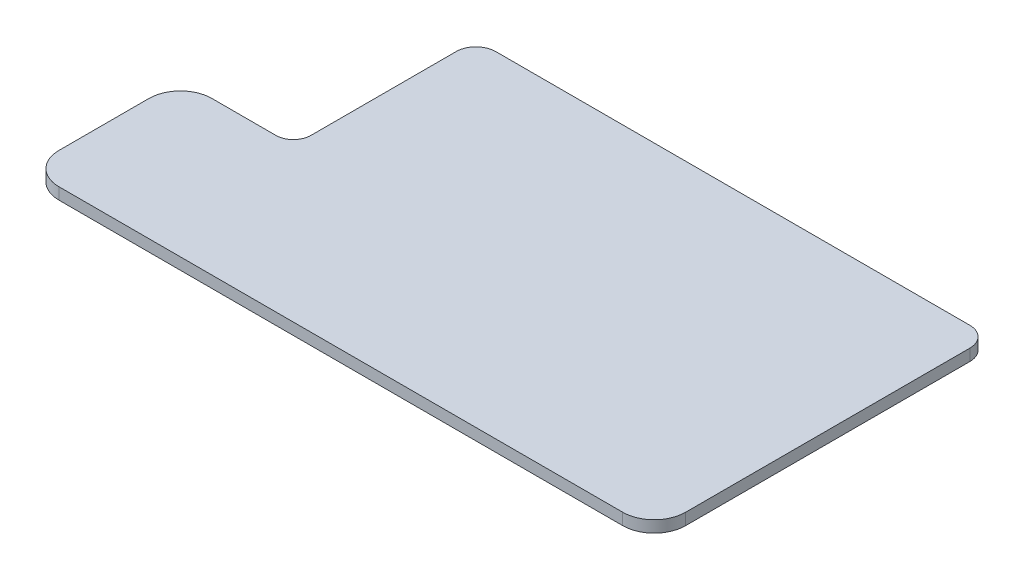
SolidWorks part; units mm, degrees
ref_plane "前视基准面" through (0, 0, 0) normal (0, 0, 1) x (1, 0, 0)
ref_plane "上视基准面" through (0, 0, 0) normal (0, 1, 0) x (1, 0, 0)
ref_plane "右视基准面" through (0, 0, 0) normal (1, 0, 0) x (0, 0, -1)
sketch "草图1" plane through (0, 0, 0) normal (0, 1, 0) x (1, 0, 0)
  line L1 (-26.9, 14.4) -> (26.9, 14.4)
  line L2 (-26.9, 14.4) -> (-26.9, -14.4)
  line L3 (-26.9, -14.4) -> (26.9, -14.4)
  line L4 (26.9, 14.4) -> (26.9, -14.4)
  line L5 (-26.9, 14.4) -> (26.9, -14.4) construction
  line L6 (-26.9, -14.4) -> (26.9, 14.4) construction
  point P0 (0, 0)
  dimension "D1" = 53.8
  dimension "D2" = 28.8
base flange "基体-法兰1" sketch "草图1" thickness 1 reverse thickness direction no parameters "D1"=0.7366
sketch "草图6" plane through (0, -1, 0) normal (0, -1, 0) x (1, 0, 0)
  line L0 (-26.9, 1.2705) -> (-17.2, 1.2705)
  line L1 (-26.9, -14.4) -> (-26.9, 14.4) construction
  line L2 (-17.2, 1.2705) -> (-17.2, -14.4)
  line L3 (26.9, -14.4) -> (-26.9, -14.4) construction
  line L6 (-26.9, 1.2705) -> (-26.9, -14.4)
  line L7 (-26.9, -14.4) -> (-17.2, -14.4)
  line L8 (-23.565, 1.1205) -> (-19.435, 1.1205) construction
  dimension "D1" = 0.15
  dimension "D2" = 9.7
extrude "切除-拉伸1" cut sketch "草图6" against normal blind 2.5
fillet "圆角1" radius 1.7 2 edges at (26.9, -0.5, -14.4) (-17.2, -0.5, -14.4)
fillet "圆角2" radius 2.7 3 edges at (26.9, -0.5, 14.4) (-26.9, -0.5, 14.4) (-26.9, -0.5, 1.2705)
fillet "圆角3" radius 1.5 1 edges at (-17.2, -0.5, 1.2705)
sketch "折弯-线1" [suppressed] plane through (0, 0, 0) normal (0, 1, 0) x (1, 0, 0)
sketch "边界框1" [suppressed] plane through (0, 0, 0) normal (0, 1, 0) x (1, 0, 0)
sheet metal parameters "钣金6" thickness 1 parameters "D1"=0.7366
flat pattern "平板型式6"
sketch "折弯-线2" plane through (0, 0, 0) normal (0, 1, 0) x (1, 0, 0)
sketch "边界框2" [suppressed] plane through (0, 0, 0) normal (0, 1, 0) x (1, 0, 0)
sheet metal parameters "钣金7" thickness 1 parameters "D1"=0.7366
flat pattern "平板型式6"
sketch "折弯-线2" plane through (0, 0, 0) normal (0, 1, 0) x (1, 0, 0)
sketch3d "边界框2" [suppressed]
  line L0 (-26.9, -14.4, 0) -> (26.9, -14.4, 0) construction
  line L1 (-26.9, 14.4, 0) -> (26.9, 14.4, 0) construction
  line L2 (-26.9, -14.4, 0) -> (-26.9, 14.4, 0) construction
  line L3 (26.9, -14.4, 0) -> (26.9, 14.4, 0) construction
